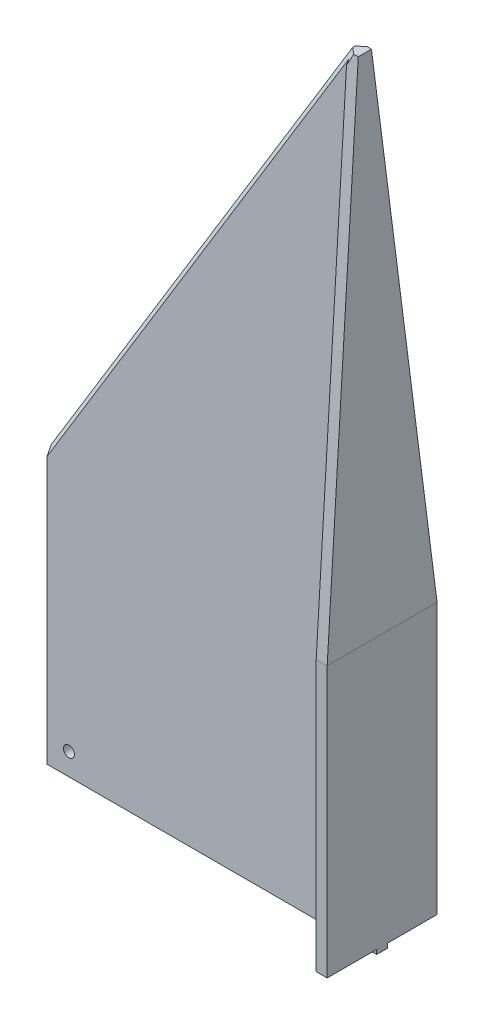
SolidWorks part; units mm, degrees
ref_plane "Front Plane" through (0, 0, 0) normal (0, 0, 1) x (1, 0, 0)
ref_plane "Top Plane" through (0, 0, 0) normal (0, 1, 0) x (1, 0, 0)
ref_plane "Right Plane" through (0, 0, 0) normal (1, 0, 0) x (0, 0, -1)
sketch "Sketch1" plane through (0, 0, 0) normal (0, 0, 1) x (1, 0, 0)
  line L0 (0, -125) -> (0, 0)
  line L1 (-7.8572, 225) -> (-12.8572, 225)
  line L2 (-12.8572, 225) -> (-150, 0)
  line L3 (-150, 0) -> (-150, -125)
  line L4 (-150, -125) -> (0, -125)
  line L5 (0, 0) -> (-7.8572, 225)
  line L6 (0, 0) -> (-150, 0) construction
  dimension "D1" = 350
  dimension "D2" = 125
  dimension "D3" = 150
  dimension "D4" = 5
  dimension "D5" = 88
extrude "main" add sketch "Sketch1" along normal mid plane 5
sketch "Sketch2" plane through (0, 0, 0) normal (0, 0, 1) x (1, 0, 0)
  line L1 (0, 0) -> (-7.8572, 225)
  line L2 (0, -123) -> (-5, -123)
  line L3 (0, -123) -> (0, 0)
  line L4 (-150, -125) -> (0, -125) construction
  line L6 (-5, -123) -> (-5, 0)
  line L7 (-7.8572, 225) -> (-12.8572, 225)
  line L8 (-12.8572, 225) -> (-5, 0)
  dimension "D1" = 5
  dimension "D2" = 2
extrude "edge extrude" add sketch "Sketch2" along normal mid plane 50
chamfer "edge extrude chamfer (1of2)" distance 22 distance2 225 1 edges at (-10.3572, 225, 25)
chamfer "edge extrude chamfer (2of2)" distance 225 distance2 22 1 edges at (-10.3572, 225, -25)
sketch "Sketch3" plane through (0, 0, 0) normal (0, 0, 1) x (1, 0, 0)
  line L0 (-150, 0) -> (-150, -125) construction
  line L1 (-150, -125) -> (0, -125) construction
  circle A0 centre (-140, -115) radius 2.5
  dimension "D1" = 5
  dimension "D2" = 10
  dimension "D3" = 10
extrude "stock mount hole" cut sketch "Sketch3" against normal through all and the other way through all
chamfer "chamfer fluke as blade" distance 2 angle 45 2 edges at (-81.4286, 112.5, -2.5) (-81.4286, 112.5, 2.5)
